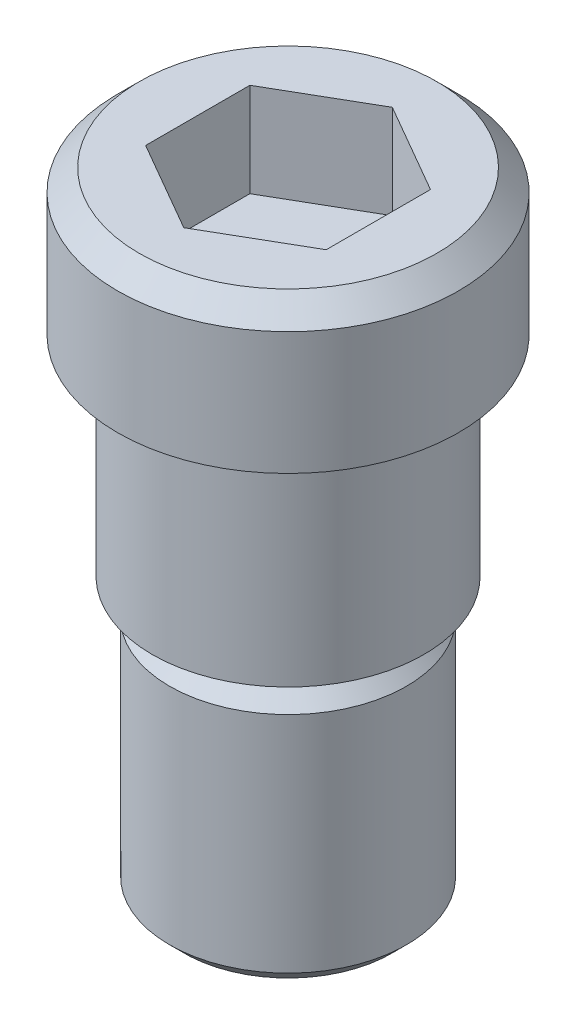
SolidWorks part; units mm, degrees
ref_plane "Front Plane" through (0, 0, 0) normal (0, 0, 1) x (1, 0, 0)
ref_plane "Top Plane" through (0, 0, 0) normal (0, 1, 0) x (1, 0, 0)
ref_plane "Right Plane" through (0, 0, 0) normal (1, 0, 0) x (0, 0, -1)
sketch "Sketch1" plane through (0, 0, 0) normal (0, 0, 1) x (1, 0, 0)
  line L0 (0, 2.54) -> (-2.9972, 2.54)
  line L1 (0, -55) -> (0, 55) construction
  line L2 (-2.9972, 2.54) -> (-2.9972, 0)
  line L3 (55, 0) -> (-55, 0) construction
  line L4 (-2.9972, 0) -> (-1.9907, 0)
  line L5 (-2.3876, -0.381) -> (-2.3876, -3.683)
  line L6 (-2.3876, -3.683) -> (-1.6859, -3.683)
  line L7 (-2.0828, -8.509) -> (-2.0828, -4.064)
  line L8 (-2.0828, -8.509) -> (0, -8.509)
  line L9 (0, -8.509) -> (0, 2.54)
  line L10 (-2.3876, -0.381) -> (-1.9907, -0.381)
  line L11 (0, 7.8779) -> (0, -15.9437) construction
  line L12 (-2.0828, -4.064) -> (-1.6859, -4.064)
  line L13 (-1.6859, -4.064) -> (-1.6859, -3.683)
  line L14 (-1.9907, -0.381) -> (-1.9907, 0)
  dimension "D1" = 5.9944
  dimension "D2" = 4.1656
  dimension "D3" = 2.54
  dimension "D4" = 3.683
  dimension "D5" = 4.826
  dimension "D6" = 4.7752
  dimension "D7" = 0.381
  dimension "D8" = 0.3969
  dimension "D9" = 0.381
  dimension "D10" = 0.3969
revolve "Revolve2" add sketch "Sketch1" angle 360 about L11
chamfer "Chamfer1" distance 0.381 angle 45 1 edges at (0, 2.54, 2.9972)
chamfer "Chamfer2" distance 0.254 angle 45 1 edges at (0, -8.509, 2.0828)
sketch "Sketch2" plane through (0, 2.54, 0) normal (0, 1, 0) x (1, 0, 0)
  line L0 (0, 0.8407) -> (0, -49999.1593) construction
  line L2 (-1.5875, -0.9165) -> (-1.5875, 0.9165)
  line L3 (-1.5875, 0.9165) -> (0, 1.8331)
  line L4 (0, -55) -> (0, 55) construction
  line L5 (0, 1.8331) -> (1.5875, 0.9165)
  line L6 (1.5875, 0.9165) -> (1.5875, -0.9165)
  line L7 (-1.5875, -0.9165) -> (0, -1.8331)
  line L8 (0, -1.8331) -> (1.5875, -0.9165)
  line L9 (-3.9571, 0) -> (-50003.9571, 0) construction
  point P7 (0, 0)
  dimension "D3" = 3.175
  dimension "D4" = 120
extrude "Cut-Extrude1" cut sketch "Sketch2" against normal blind 1.651
chamfer "Chamfer3" distance 0.254 angle 45 1 edges at (0, -4.064, 2.0828)
